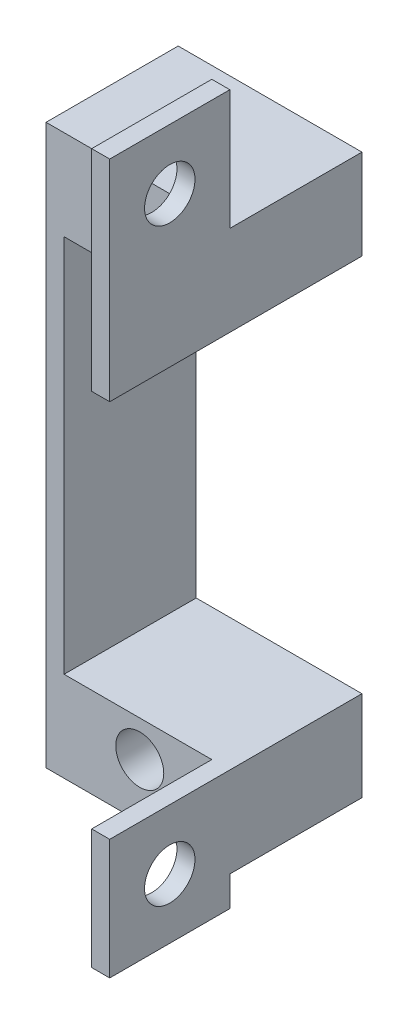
SolidWorks part; units mm, degrees
ref_plane "Front Plane" through (0, 0, 0) normal (0, 0, 1) x (1, 0, 0)
ref_plane "Top Plane" through (0, 0, 0) normal (0, 1, 0) x (1, 0, 0)
ref_plane "Right Plane" through (0, 0, 0) normal (1, 0, 0) x (0, 0, -1)
sketch "Sketch17" plane through (0, 0, 0) normal (0, 0, 1) x (1, 0, 0)
  line L1 (-9.5785, 42.9232) -> (-24.8785, 42.9232)
  line L2 (-9.5785, 42.9232) -> (-9.5785, 35.4232)
  line L3 (-9.5785, 35.4232) -> (-24.8785, 35.4232)
  line L4 (-24.8785, 42.9232) -> (-24.8785, 35.4232)
  dimension "D1" = 15.3
  dimension "D2" = 7.5
extrude "Boss-Extrude12" add sketch "Sketch17" along normal blind 11 separate body
sketch "Sketch18" plane through (0, 35.4232, 0) normal (0, -1, 0) x (1, 0, 0)
  line L0 (-24.8785, 0) -> (-9.5785, 0) construction
  line L1 (-24.8785, 11) -> (-23.3785, 11)
  line L2 (-24.8785, 11) -> (-24.8785, 0)
  line L3 (-24.8785, 0) -> (-23.3785, 0)
  line L4 (-23.3785, 11) -> (-23.3785, 0)
  dimension "D1" = 1.5
extrude "Boss-Extrude13" add sketch "Sketch18" along normal blind 15.775
sketch "Sketch19" plane through (0, 0, 11) normal (0, 0, 1) x (1, 0, 0)
  line L0 (-9.5785, 35.4232) -> (-9.5785, 42.9232) construction
  line L1 (-23.3785, 35.4232) -> (-9.5785, 35.4232) construction
  circle A0 centre (-17.0785, 38.4232) radius 2
  dimension "D1" = 7.5
  dimension "D2" = 3
  dimension "D3" = 4
extrude "Cut-Extrude2" cut sketch "Sketch19" against normal through all
sketch "Sketch21" plane through (0, 0, 11) normal (0, 0, 1) x (1, 0, 0)
  line L1 (-9.5785, 35.4232) -> (-11.0785, 35.4232)
  line L2 (-9.5785, 35.4232) -> (-9.5785, 42.9232)
  line L3 (-9.5785, 42.9232) -> (-11.0785, 42.9232)
  line L4 (-11.0785, 35.4232) -> (-11.0785, 42.9232)
  dimension "D1" = 1.5
  dimension "D2" = 7.5
extrude "Boss-Extrude14" add sketch "Sketch21" along normal blind 10 contours L2 L1 L4 L3
sketch "Sketch22" plane through (0, 42.9232, 0) normal (0, 1, 0) x (1, 0, 0)
  line L0 (-9.5785, -21) -> (-9.5785, 0) construction
  line L1 (-11.0785, -21) -> (-9.5785, -21)
  line L2 (-11.0785, -21) -> (-11.0785, -11)
  line L3 (-11.0785, -11) -> (-9.5785, -11)
  line L4 (-9.5785, -21) -> (-9.5785, -11)
extrude "Boss-Extrude15" add sketch "Sketch22" along normal blind 10
sketch "Sketch23" plane through (-11.0785, 0, 0) normal (-1, 0, 0) x (0, 0, 1)
  line L0 (21, 35.4232) -> (21, 52.9232) construction
  line L1 (11, 52.9232) -> (21, 52.9232) construction
  circle A0 centre (16, 47.9232) radius 2.1
  dimension "D1" = 4.2
  dimension "D2" = 5
  dimension "D3" = 5
extrude "Cut-Extrude4" cut sketch "Sketch23" against normal blind 10
ref_plane "Plane1" through (0, 19.6482, 0) normal (0, -1, 0) x (-1, 0, 0)
sketch "Sketch25" plane through (0, 19.6482, 0) normal (0, -1, 0) x (1, 0, 0)
  line L1 (-24.8785, 11) -> (-23.3785, 11)
  line L2 (-24.8785, 11) -> (-24.8785, 0)
  line L3 (-24.8785, 0) -> (-23.3785, 0)
  line L4 (-23.3785, 11) -> (-23.3785, 0)
extrude "Boss-Extrude16" add sketch "Sketch25" along normal blind 23.275
sketch "Sketch26" plane through (-23.3785, 0, 0) normal (1, 0, 0) x (0, 0, -1)
  line L0 (0, -3.6268) -> (0, 35.4232) construction
  line L1 (-11, -3.6268) -> (0, -3.6268)
  line L2 (-11, -3.6268) -> (-11, 3.8732)
  line L3 (-11, 3.8732) -> (0, 3.8732)
  line L4 (0, -3.6268) -> (0, 3.8732)
  dimension "D1" = 7.5
extrude "Boss-Extrude17" add sketch "Sketch26" along normal up to surface (13.8 mm away)
mirror "Mirror12" about plane through (0, 19.6482, 0) normal (0, -1, 0) of "Cut-Extrude2"
sketch "Sketch27" plane through (0, 0, 11) normal (0, 0, 1) x (1, 0, 0)
  line L0 (-9.5785, 3.8732) -> (-23.3785, 3.8732) construction
  line L1 (-9.5785, -3.6268) -> (-11.0785, -3.6268)
  line L2 (-9.5785, -3.6268) -> (-9.5785, 3.8732)
  line L3 (-9.5785, 3.8732) -> (-11.0785, 3.8732)
  line L4 (-11.0785, -3.6268) -> (-11.0785, 3.8732)
  dimension "D1" = 1.5
extrude "Boss-Extrude18" add sketch "Sketch27" along normal up to surface (10 mm away)
sketch "Sketch28" plane through (0, -3.6268, 0) normal (0, -1, 0) x (1, 0, 0)
  line L1 (-11.0785, 21) -> (-9.5785, 21)
  line L2 (-11.0785, 21) -> (-11.0785, 11)
  line L3 (-11.0785, 11) -> (-9.5785, 11)
  line L4 (-9.5785, 21) -> (-9.5785, 11)
extrude "Boss-Extrude19" add sketch "Sketch28" along normal blind 2.5
sketch "Sketch29" plane through (-11.0785, 0, 0) normal (-1, 0, 0) x (0, 0, 1)
  line L0 (21, -6.1268) -> (21, 3.8732) construction
  line L2 (21, 3.8732) -> (11, 3.8732) construction
  circle A0 centre (16, -1.1268) radius 2.1
  dimension "D1" = 4.2
  dimension "D2" = 5
  dimension "D3" = 5
extrude "Cut-Extrude5" cut sketch "Sketch29" against normal through all
